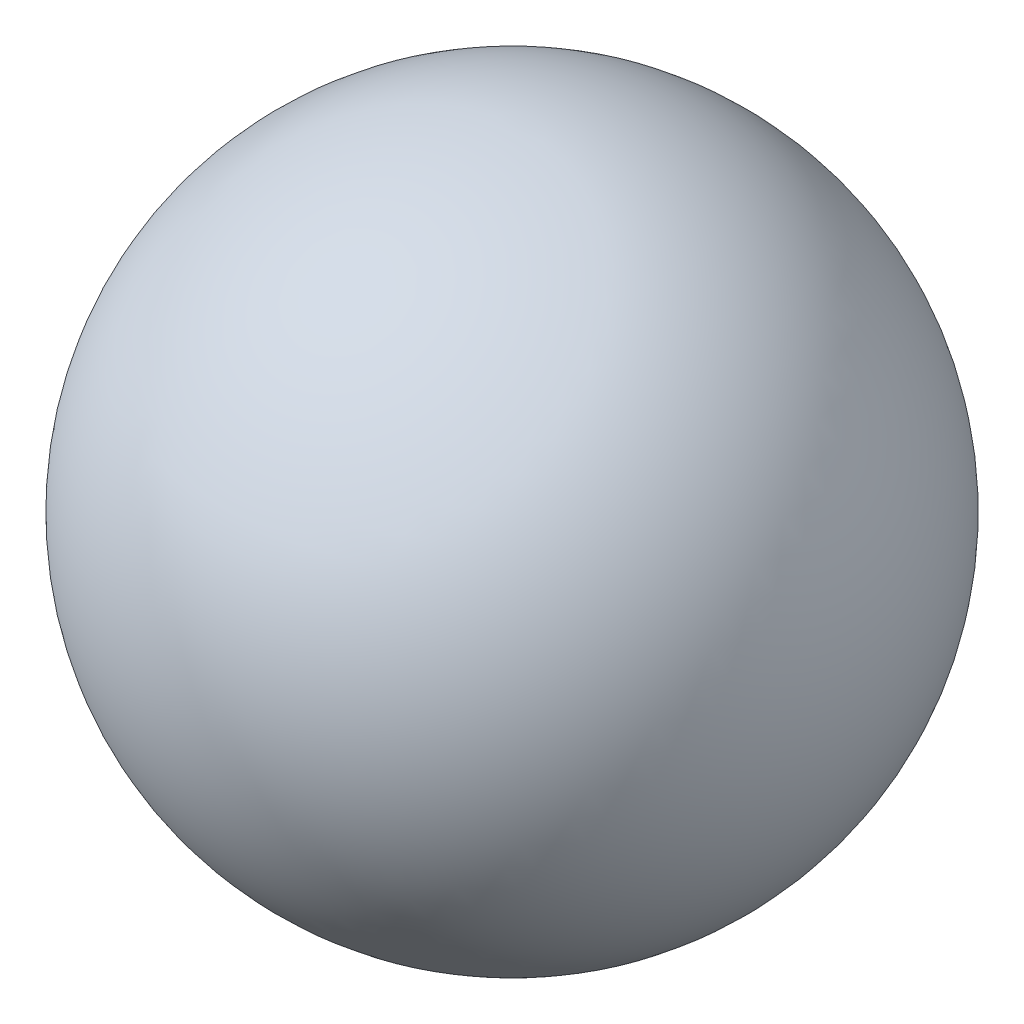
SolidWorks part; units mm, degrees
ref_plane "Plan de face" through (0, 0, 0) normal (0, 0, 1) x (1, 0, 0)
ref_plane "Plan de dessus" through (0, 0, 0) normal (0, 1, 0) x (1, 0, 0)
ref_plane "Plan de droite" through (0, 0, 0) normal (1, 0, 0) x (0, 0, -1)
sketch "Esquisse1" plane through (0, 0, 0) normal (0, 0, 1) x (1, 0, 0)
  line L0 (0, 36) -> (0, 17.5) construction
  line L1 (-12.4, 36) -> (12.4, 36) construction
  line L2 (-13.5, 34.9) -> (-13.5, 18.6) construction
  line L3 (-12.4, 17.5) -> (12.4, 17.5) construction
  line L4 (13.5, 34.9) -> (13.5, 18.6) construction
  line L5 (13.5, 29.05) -> (-13.5, 29.05) construction
  line L6 (13.5, 24.45) -> (-13.5, 24.45) construction
  line L7 (-13.5, 26.75) -> (13.5, 26.75) construction
  line L8 (-6.0417, 17.5) -> (-6.0417, 36) construction
  line L9 (0, 0) -> (13.5, 0) construction
  line L10 (-6.0417, 31.375) -> (-6.0417, 22.125)
  arc A1 (-13.5, 18.6) -> (-12.4, 17.5) centre (-12.4, 18.6) ccw construction
  arc A2 (-12.4, 36) -> (-13.5, 34.9) centre (-12.4, 34.9) ccw construction
  arc A3 (13.5, 34.9) -> (12.4, 36) centre (12.4, 34.9) ccw construction
  arc A4 (12.4, 17.5) -> (13.5, 18.6) centre (12.4, 18.6) ccw construction
  arc A6 (-6.0417, 31.375) -> (-6.0417, 22.125) centre (-6.0417, 26.75) ccw
  circle A7 centre (6.0417, 26.75) radius 4.625 construction
  dimension "D4" = 1.1
  dimension "D5" = 7.4583
  dimension "D8" = 9.25
  dimension "D1" = 17.5
  dimension "D2" = 36
  dimension "D3" = 27
  dimension "D6" = 24.45
  dimension "D7" = 29.05
revolve "Révolution1" add sketch "Esquisse1" angle 360 about L10
equation "\"D5@Esquisse1\"=(\"D3@Esquisse1\"-2*\"D8@Esquisse1\")/3+\"D8@Esquisse1\"/2"
